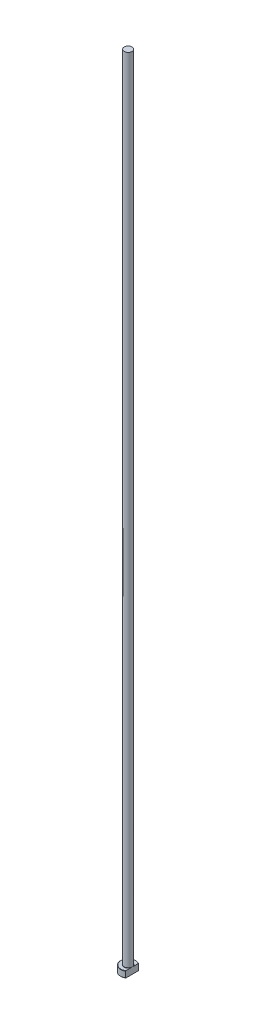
SolidWorks part; units mm, degrees
ref_plane "Front Plane" through (0, 0, 0) normal (0, 0, 1) x (1, 0, 0)
ref_plane "Top Plane" through (0, 0, 0) normal (0, 1, 0) x (1, 0, 0)
ref_plane "Right Plane" through (0, 0, 0) normal (1, 0, 0) x (0, 0, -1)
sketch "Sketch1" plane through (0, 0, 0) normal (0, 0, 1) x (1, 0, 0)
  line L0 (0, 259.9588) -> (0, -15.1925) construction
  line L1 (0, 0) -> (-6, 0)
  line L2 (-6, 0) -> (-6, 5)
  line L3 (-6, 5) -> (-3.1, 5)
  line L4 (-3.1, 5) -> (-3.1, 630)
  line L5 (-3.1, 630) -> (0, 630)
  line L6 (0, 630) -> (0, 0)
  dimension "L" = 630
  dimension "H" = 12
  dimension "T" = 5
  dimension "D" = 6.2
revolve "Revolve1" add sketch "Sketch1" angle 360 about L0
chamfer "Chamfer1" distance 0.2 angle 45 2 edges at (0, 5, 6) (0, 0, 6)
fillet "Fillet1" radius 0.2 1 edges at (0, 5, 3.1)
sketch "Sketch2" plane through (0, 0, 0) normal (0, 1, 0) x (1, 0, 0)
  line L0 (3.1, 5.1371) -> (3.1, -5.1371)
  circle A0 centre (0, 0) radius 6 construction
  arc A1 (3.1, -5.1371) -> (3.1, 5.1371) centre (0, 0) ccw
  circle A2 centre (0, 0) radius 3.1 construction
extrude "KEY" cut sketch "Sketch2" along normal through all
